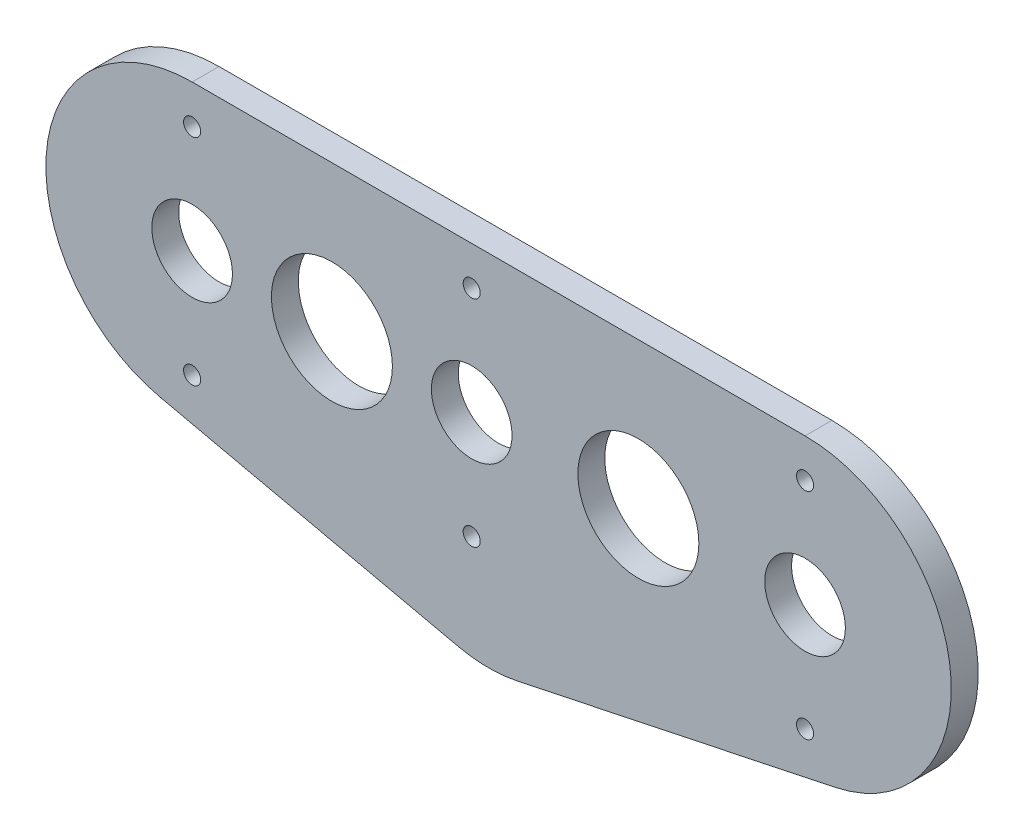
SolidWorks part; units mm, degrees
ref_plane "Front Plane" through (0, 0, 0) normal (0, 0, 1) x (1, 0, 0)
ref_plane "Top Plane" through (0, 0, 0) normal (0, 1, 0) x (1, 0, 0)
ref_plane "Right Plane" through (0, 0, 0) normal (1, 0, 0) x (0, 0, -1)
sketch "Sketch1" plane through (0, 0, 0) normal (0, 0, 1) x (1, 0, 0)
  line L0 (-70.031, 17.272) -> (-3.991, 17.272) construction
  line L1 (-3.991, 17.272) -> (74.749, 17.272) construction
  line L2 (-70.031, 49.276) -> (74.749, 49.276)
  line L3 (-70.031, 42.672) -> (74.749, 42.672) construction
  line L4 (-70.031, 42.672) -> (-70.031, -8.128) construction
  line L5 (-70.031, -8.128) -> (74.749, -8.128) construction
  line L6 (74.749, 42.672) -> (74.749, -8.128) construction
  line L7 (-70.031, -14.732) -> (-29.9849, -14.732) construction
  line L8 (0, -27.94) -> (0, -14.732) construction
  line L9 (-23.7405, -14.732) -> (23.7405, -14.732) construction
  line L10 (29.9849, -14.732) -> (74.749, -14.732) construction
  line L11 (-29.9849, -14.732) -> (-23.7405, -14.732) construction
  line L12 (29.9849, -14.732) -> (23.7405, -14.732) construction
  line L13 (-77.0364, -13.9559) -> (-6.6718, -29.7408)
  line L14 (81.3334, -14.0474) -> (6.2708, -29.828)
  circle A0 centre (-70.031, 17.272) radius 32.004 construction
  circle A1 centre (-3.991, 17.272) radius 32.004 construction
  circle A2 centre (74.749, 17.272) radius 32.004 construction
  circle A3 centre (-70.031, 17.272) radius 7.62 construction
  circle A4 centre (-3.991, 17.272) radius 7.62 construction
  circle A5 centre (74.749, 17.272) radius 7.62 construction
  circle A6 centre (-37.011, 17.272) radius 25.4 construction
  circle A7 centre (35.379, 17.272) radius 31.75 construction
  circle A8 centre (35.379, 17.272) radius 11.43 construction
  circle A9 centre (0, 0) radius 27.94 construction
  circle A10 centre (-70.031, 17.272) radius 25.4 construction
  circle A11 centre (-3.991, 17.272) radius 25.4 construction
  circle A12 centre (74.749, 17.272) radius 25.4 construction
  circle A13 centre (-70.031, 42.672) radius 2.0193
  circle A14 centre (-3.991, 42.672) radius 2.0193
  circle A15 centre (74.749, 42.672) radius 2.0193
  circle A16 centre (74.749, -8.128) radius 2.0193
  circle A17 centre (-3.991, -8.128) radius 2.0193
  circle A18 centre (-70.031, -8.128) radius 2.0193
  arc A19 (-70.031, 49.276) -> (-70.031, -14.732) centre (-70.031, 17.272) ccw construction
  arc A20 (74.749, -14.732) -> (74.749, 49.276) centre (74.749, 17.272) ccw construction
  circle A21 centre (-70.031, 17.272) radius 9.525
  circle A22 centre (-3.991, 17.272) radius 9.525
  circle A23 centre (74.749, 17.272) radius 9.525
  circle A24 centre (-37.011, 17.272) radius 14.2875
  circle A25 centre (35.379, 17.272) radius 14.2875
  arc A26 (-20.6146, -18.8595) -> (20.6146, -18.8595) centre (0, 0) ccw construction
  arc A27 (20.6146, -18.8595) -> (29.9849, -14.732) centre (29.9849, -27.432) cw construction
  arc A28 (-29.9849, -14.732) -> (-20.6146, -18.8595) centre (-29.9849, -27.432) cw construction
  arc A29 (-6.6718, -29.7408) -> (6.2708, -29.828) centre (0, 0) ccw
  arc A30 (81.3334, -14.0474) -> (74.749, 49.276) centre (74.749, 17.272) ccw
  arc A31 (-70.031, 49.276) -> (-77.0364, -13.9559) centre (-70.031, 17.272) ccw
  circle A32 centre (0, 0) radius 30.48 construction
  dimension "D1" = 64.008
  dimension "D2" = 15.24
  dimension "D3" = 50.8
  dimension "D4" = 22.86
  dimension "D5" = 55.88
  dimension "D6" = 63.5
  dimension "D7" = 50.8
  dimension "D8" = 4.0386
  dimension "D9" = 19.05
  dimension "D10" = 28.575
  dimension "D12" = 12.7
  dimension "D13" = 60.96
  dimension "D11" = 13.208
extrude "Boss-Extrude1" add sketch "Sketch1" along normal blind 6.35
sketch "Sketch2" plane through (0, 0, 6.35) normal (0, 0, 1) x (1, 0, 0)
  line L0 (-77.5923, -16.4343) -> (-7.2278, -32.2192)
  line L1 (6.7934, -32.3136) -> (81.8559, -16.533)
  line L2 (74.749, 51.816) -> (-70.031, 51.816)
  line L3 (-77.0364, -13.9559) -> (-6.6718, -29.7408)
  line L4 (6.2708, -29.828) -> (81.3334, -14.0474)
  line L5 (74.749, 49.276) -> (-70.031, 49.276)
  line L6 (-77.0364, -13.9559) -> (-6.6718, -29.7408)
  line L7 (6.2708, -29.828) -> (81.3334, -14.0474)
  line L8 (74.749, 49.276) -> (-70.031, 49.276)
  arc A0 (-7.2278, -32.2192) -> (6.7934, -32.3136) centre (0, 0) ccw
  arc A1 (81.8559, -16.533) -> (74.749, 51.816) centre (74.749, 17.272) ccw
  arc A2 (-70.031, 51.816) -> (-77.5923, -16.4343) centre (-70.031, 17.272) ccw
  arc A3 (-70.031, 49.276) -> (-77.0364, -13.9559) centre (-70.031, 17.272) ccw
  arc A4 (-6.6718, -29.7408) -> (6.2708, -29.828) centre (0, 0) ccw
  arc A5 (81.3334, -14.0474) -> (74.749, 49.276) centre (74.749, 17.272) ccw
  arc A6 (-70.031, 49.276) -> (-77.0364, -13.9559) centre (-70.031, 17.272) ccw
  arc A7 (-6.6718, -29.7408) -> (6.2708, -29.828) centre (0, 0) ccw
  arc A8 (81.3334, -14.0474) -> (74.749, 49.276) centre (74.749, 17.272) ccw
  dimension "D1" = 0
  dimension "D2" = 2.54
extrude "Boss-Extrude2" add sketch "Sketch2" against normal up to surface (6.35 mm away)
sketch "Sketch3" plane through (0, 0, 0) normal (0, 0, 1) x (1, 0, 0)
  circle A0 centre (-3.991, 42.672) radius 6.35
  circle A1 centre (-70.031, 42.672) radius 6.35
  circle A2 centre (-70.031, -8.128) radius 6.35
  circle A4 centre (74.749, -8.128) radius 6.6368
  circle A5 centre (74.749, 42.672) radius 6.6368
  dimension "D1" = 12.7
extrude "Cut-Extrude1" cut sketch "Sketch3" along normal blind 1.5875
sketch "Sketch4" plane through (0, 0, 0) normal (0, 0, -1) x (-1, 0, 0)
  line L0 (34.6297, 47.0535) -> (34.6297, 35.8656)
  line L1 (39.3922, 47.0535) -> (39.3922, 36.5579)
  line L2 (39.3922, 47.0535) -> (39.3922, 37.9095) construction
  line L3 (37.011, 47.0535) -> (37.011, 37.9095)
  line L4 (3.991, 42.672) -> (3.991, 31.61)
  line L5 (70.031, 42.672) -> (70.031, 32.2762)
  line L6 (70.031, 47.0535) -> (-74.749, 47.0535)
  line L7 (-80.8761, -11.8724) -> (-5.8136, -27.653)
  line L8 (6.1853, -27.5722) -> (76.5499, -11.7873)
  line L9 (70.031, 47.0535) -> (-74.749, 47.0535)
  line L10 (-80.8761, -11.8724) -> (-5.8136, -27.653)
  line L11 (6.1853, -27.5722) -> (76.5499, -11.7873)
  line L12 (-35.379, 47.0535) -> (-35.379, 35.8656)
  line L13 (34.6297, 47.0535) -> (34.6297, 37.9095) construction
  line L14 (70.031, -8.128) -> (70.031, 17.272)
  line L15 (-74.749, 17.272) -> (3.991, 17.272)
  line L16 (-74.749, 42.672) -> (-74.749, 17.272)
  line L17 (-74.749, 17.272) -> (-74.749, -8.128)
  line L18 (3.991, 17.272) -> (3.991, -27.9742)
  line L19 (3.991, -27.9742) -> (39.4531, -1.3988)
  line L20 (39.4531, -1.3988) -> (67.9227, -15.2605)
  line L21 (3.991, -27.9742) -> (-35.379, -1.3691)
  line L22 (-35.379, -1.3691) -> (-71.2909, -13.8875)
  line L26 (6.3722, 42.672) -> (6.3722, 31.61)
  line L27 (72.4122, 42.672) -> (72.4122, 32.2762)
  line L28 (-32.9978, 47.0535) -> (-32.9978, 35.8656)
  line L29 (-72.3678, 42.672) -> (-72.3678, 17.272)
  line L30 (-72.3678, 17.272) -> (-72.3678, -8.128)
  line L31 (-74.749, 19.6533) -> (6.3722, 19.6532)
  line L32 (6.3722, 19.6532) -> (6.3722, -23.214)
  line L33 (6.3722, -23.214) -> (39.1884, 1.3786)
  line L34 (39.1884, 1.3786) -> (68.9651, -13.1195)
  line L35 (-34.5952, -3.6177) -> (-70.5071, -16.1361)
  line L36 (1.6097, 42.672) -> (1.6097, 31.61)
  line L37 (67.6497, 42.672) -> (67.6497, 32.2762)
  line L38 (-37.7603, 47.0535) -> (-37.7603, 35.8656)
  line L39 (-77.1303, 42.672) -> (-77.1303, 17.272)
  line L40 (-77.1303, 17.272) -> (-77.1303, -8.128)
  line L41 (-74.749, 14.8908) -> (1.6097, 14.8907)
  line L42 (1.6097, 14.8907) -> (1.6097, -32.7345)
  line L43 (1.6097, -32.7345) -> (39.7178, -4.1761)
  line L44 (39.7178, -4.1761) -> (66.8803, -17.4014)
  line L45 (-36.1628, 0.8794) -> (-72.0747, -11.639)
  line L46 (5.3243, -26.0013) -> (-34.0457, 0.6038)
  line L47 (2.6577, -29.9472) -> (-36.7123, -3.3421)
  line L48 (72.4122, -8.128) -> (72.4122, 17.272)
  line L49 (67.6497, -8.128) -> (67.6497, 17.272)
  circle A1 centre (3.991, 42.672) radius 7.9375
  circle A2 centre (70.031, 42.672) radius 7.9375
  circle A3 centre (70.031, -8.128) radius 7.9375
  circle A4 centre (3.991, -8.128) radius 7.9375
  circle A5 centre (-74.749, -8.128) radius 7.9375
  circle A6 centre (-74.749, 42.672) radius 7.9375
  arc A12 (76.5499, -11.7873) -> (70.031, 47.0535) centre (70.031, 17.272) ccw
  arc A13 (-74.749, 47.0535) -> (-80.8761, -11.8724) centre (-74.749, 17.272) ccw
  arc A14 (-5.8136, -27.653) -> (6.1853, -27.5722) centre (0, 0) ccw
  arc A15 (76.5499, -11.7873) -> (70.031, 47.0535) centre (70.031, 17.272) ccw
  arc A16 (-74.749, 47.0535) -> (-80.8761, -11.8724) centre (-74.749, 17.272) ccw
  arc A17 (-5.8136, -27.653) -> (6.1853, -27.5722) centre (0, 0) ccw
  circle A20 centre (-74.749, 17.272) radius 15.875
  circle A21 centre (-74.749, 17.272) radius 15.875
  circle A23 centre (-35.379, 17.272) radius 20.6375
  circle A24 centre (-35.379, 17.272) radius 20.6375
  circle A26 centre (3.991, 17.272) radius 15.875
  circle A27 centre (3.991, 17.272) radius 15.875
  circle A29 centre (37.011, 17.272) radius 20.6375
  circle A30 centre (37.011, 17.272) radius 20.6375
  circle A32 centre (70.031, 17.272) radius 15.875
  circle A33 centre (70.031, 17.272) radius 15.875
  dimension "D13" = 2.3813
  dimension "D1" = 15.875
  dimension "D2" = 4.7625
  dimension "D3" = 6.35
  dimension "D4" = 6.35
  dimension "D5" = 6.35
  dimension "D6" = 6.35
  dimension "D7" = 6.35
  dimension "D8" = 2.3813
  dimension "D9" = 2.3813
  dimension "D10" = 2.3813
  dimension "D11" = 2.3813
  dimension "D12" = 2.3813
  dimension "D14" = 2.3813
  dimension "D15" = 2.3813
extrude "Cut-Extrude2" cut sketch "Sketch4" against normal blind 4.7625 contours A21 L39 A6 A16 A5 L40 | A24 L38 L9 A6 L29 A21 L31 | A27 L36 A1 L9 L28 A24 L31 | A27 L41 A24 L46 L42 A4 | A24 L41 A21 L30 A5 L45 | L10 A17 L47 L35 | A30 A27 L32 A4 L33 | L44 L43 L11 | A33 A30 L34 A3 L14 | A33 L14 A3 A15 A2 L27 | A33 L37 A2 L9 L1 A30 | A30 L0 L9 A1 L26 A27
fillet "Fillet1" radius 3.81 49 edges at (-33.3055, -3.0301, 2.3813) (-9.4863, -26.8317, 2.3813) (-39.7178, -4.1761, 2.3813) (-62.0366, -15.0431, 2.3813) (-62.2865, -9.8677, 2.3813) (-45.333, -1.6132, 2.3813) (-56.1541, 9.5618, 2.3813) (-67.6497, 1.5766, 2.3813) (-77.1457, -11.6472, 2.3813) (-72.4122, 1.5766, 2.3813) (-77.1457, 46.1912, 2.3813) (-56.1541, 24.9822, 2.3813) (-72.4122, 35.1001, 2.3813) (-67.6497, 35.1001, 2.3813) (-63.4123, 47.0535, 2.3813) (-39.3922, 47.0535, 2.3813) (-39.3922, 37.7717, 2.3813) (-34.6297, 37.7717, 2.3813) (-34.6297, 47.0535, 2.3813) (-17.8679, 9.5618, 2.3813) (-17.8679, 24.9822, 2.3813) (-10.6096, 47.0535, 2.3813) (-6.3722, 32.9674, 2.3813) (2.6277, 47.0535, 2.3813) (-1.6097, 32.9674, 2.3813) (-1.6097, 1.5766, 2.3813) (81.8637, -11.6472, 2.3813) (77.1303, -0.5561, 2.3813) (32.9978, 37.7717, 2.3813) (14.8794, 19.6533, 2.3813) (14.8794, 14.8908, 2.3813) (29.4565, -2.4974, 2.3813) (-6.3722, -23.214, 2.3813) (-1.6097, -23.4911, 2.3813) (-0.1566, -28.2571, 2.3813) (35.7229, -4.0108, 2.3813) (66.7782, -14.8362, 2.3813) (72.3678, -0.5561, 2.3813) (67.0055, -9.8719, 2.3813) (43.5287, -1.6882, 2.3813) (55.8787, 14.8908, 2.3813) (55.8787, 19.6533, 2.3813) (37.7603, 37.7717, 2.3813) (81.8637, 46.1912, 2.3813) (77.1303, 35.1001, 2.3813) (72.3678, 35.1001, 2.3813) (68.1304, 47.0535, 2.3813) (32.9978, 47.0535, 2.3813) (37.7603, 47.0535, 2.3813)
sketch "Sketch5" plane through (0, 0, 0) normal (0, 0, -1) x (-1, 0, 0)
  line L0 (51.4159, -4.5749) -> (57.3503, -7.4643) construction
  line L1 (58.2974, 47.0535) -> (43.2022, 47.0535) construction
  line L2 (12.4657, -18.6475) -> (27.6469, -7.2707)
  line L3 (-11.7044, 14.8907) -> (-11.7285, 14.8907)
  line L4 (-23.9448, -6.2221) -> (-4.3335, -19.4748)
  line L5 (1.6097, -16.318) -> (1.6097, -15.6999)
  line L6 (-11.7044, 14.8907) -> (-11.7285, 14.8907)
  line L7 (-23.9448, -6.2221) -> (-4.3335, -19.4748)
  line L8 (1.6097, -16.318) -> (1.6097, -15.6999)
  line L9 (6.3722, 1.5766) -> (6.3722, -0.5561)
  line L10 (12.4657, -18.6475) -> (27.6469, -7.2707)
  line L11 (6.3722, 1.5766) -> (6.3722, -0.5561)
  line L12 (39.3922, 43.2435) -> (39.3922, 40.9226) construction
  line L13 (34.6297, 40.9226) -> (34.6297, 43.2435) construction
  line L14 (30.8197, 47.0535) -> (15.7246, 47.0535) construction
  line L15 (-7.7426, 47.0535) -> (-29.1878, 47.0535) construction
  line L16 (-32.9978, 43.2435) -> (-32.9978, 40.9226) construction
  line L17 (-11.7285, 19.6533) -> (-11.7044, 19.6533) construction
  line L18 (-59.0536, 19.6533) -> (-59.0296, 19.6533) construction
  line L19 (-37.7603, 40.9226) -> (-37.7603, 43.2435) construction
  line L20 (-41.5703, 47.0535) -> (-63.0154, 47.0535) construction
  line L21 (-62.2811, -8.2251) -> (-50.785, -4.2177) construction
  line L22 (-59.0296, 14.8908) -> (-59.0536, 14.8908) construction
  line L23 (51.4159, -4.5749) -> (57.3503, -7.4643)
  line L24 (58.2974, 47.0535) -> (43.2022, 47.0535)
  line L25 (39.3922, 43.2435) -> (39.3922, 40.9226)
  line L26 (34.6297, 40.9226) -> (34.6297, 43.2435)
  line L27 (30.8197, 47.0535) -> (15.7246, 47.0535)
  line L28 (-7.7426, 47.0535) -> (-29.1878, 47.0535)
  line L29 (-32.9978, 43.2435) -> (-32.9978, 40.9226)
  line L30 (-11.7285, 19.6533) -> (-11.7044, 19.6533)
  line L31 (-59.0536, 19.6533) -> (-59.0296, 19.6533)
  line L32 (-37.7603, 40.9226) -> (-37.7603, 43.2435)
  line L33 (-41.5703, 47.0535) -> (-63.0154, 47.0535)
  line L34 (-62.2811, -8.2251) -> (-50.785, -4.2177)
  line L35 (-59.0296, 14.8908) -> (-59.0536, 14.8908)
  arc A0 (57.3503, -7.4643) -> (62.5899, -5.365) centre (59.0182, -4.0388) ccw construction
  arc A1 (67.6497, -0.5561) -> (62.5899, -5.365) centre (70.031, -8.128) ccw construction
  arc A2 (67.6497, -0.5561) -> (65.1236, 2.1746) centre (63.9458, -1.4488) ccw construction
  arc A3 (59.2831, 5.5887) -> (65.1236, 2.1746) centre (70.031, 17.272) ccw construction
  arc A4 (59.2831, 5.5887) -> (53.6346, 5.0425) centre (56.7036, 2.7847) ccw construction
  arc A5 (50.5789, 1.7215) -> (53.6346, 5.0425) centre (37.011, 17.272) ccw construction
  arc A6 (27.6469, -7.2707) -> (27.1775, -0.8721) centre (25.3621, -4.2218) ccw
  arc A7 (1.6097, -0.5561) -> (1.6097, -15.6999) centre (3.991, -8.128) ccw
  arc A8 (1.6097, -0.5561) -> (-0.9164, 2.1746) centre (-2.0942, -1.4488) ccw
  arc A9 (-11.7044, 14.8907) -> (-0.9164, 2.1746) centre (3.991, 17.272) ccw
  arc A10 (-11.7285, 14.8907) -> (-15.4143, 12.0456) centre (-11.7285, 11.0808) ccw
  arc A11 (-23.926, 0.1042) -> (-15.4143, 12.0456) centre (-35.379, 17.272) ccw
  arc A12 (-23.926, 0.1042) -> (-23.9448, -6.2221) centre (-21.8116, -3.0653) ccw
  arc A13 (-4.3335, -19.4748) -> (1.6097, -16.318) centre (-2.2003, -16.318) ccw
  arc A14 (1.6097, -0.5561) -> (1.6097, -15.6999) centre (3.991, -8.128) ccw
  arc A15 (1.6097, -0.5561) -> (-0.9164, 2.1746) centre (-2.0942, -1.4488) ccw
  arc A16 (-11.7044, 14.8907) -> (-0.9164, 2.1746) centre (3.991, 17.272) ccw
  arc A17 (-11.7285, 14.8907) -> (-15.4143, 12.0456) centre (-11.7285, 11.0808) ccw
  arc A18 (-23.926, 0.1042) -> (-15.4143, 12.0456) centre (-35.379, 17.272) ccw
  arc A19 (-23.926, 0.1042) -> (-23.9448, -6.2221) centre (-21.8116, -3.0653) ccw
  arc A20 (-4.3335, -19.4748) -> (1.6097, -16.318) centre (-2.2003, -16.318) ccw
  arc A21 (20.3873, 5.0425) -> (27.1775, -0.8721) centre (37.011, 17.272) ccw
  arc A22 (20.3873, 5.0425) -> (14.7389, 5.5887) centre (17.3183, 2.7847) ccw
  arc A23 (6.3722, 1.5766) -> (14.7389, 5.5887) centre (3.991, 17.272) ccw
  arc A24 (6.3722, -15.6999) -> (6.3722, -0.5561) centre (3.991, -8.128) ccw
  arc A25 (6.3722, -15.6999) -> (12.4657, -18.6475) centre (10.1809, -15.5986) ccw
  arc A26 (27.6469, -7.2707) -> (27.1775, -0.8721) centre (25.3621, -4.2218) ccw
  arc A27 (20.3873, 5.0425) -> (27.1775, -0.8721) centre (37.011, 17.272) ccw
  arc A28 (20.3873, 5.0425) -> (14.7389, 5.5887) centre (17.3183, 2.7847) ccw
  arc A29 (6.3722, 1.5766) -> (14.7389, 5.5887) centre (3.991, 17.272) ccw
  arc A30 (6.3722, -15.6999) -> (6.3722, -0.5561) centre (3.991, -8.128) ccw
  arc A31 (6.3722, -15.6999) -> (12.4657, -18.6475) centre (10.1809, -15.5986) ccw
  arc A32 (50.5789, 1.7215) -> (51.4159, -4.5749) centre (53.0838, -1.1493) ccw construction
  arc A33 (77.8358, -6.6829) -> (72.4122, -0.5561) centre (70.031, -8.128) ccw construction
  arc A34 (77.8358, -6.6829) -> (83.2767, -9.4017) centre (81.5822, -5.9893) ccw construction
  arc A35 (83.2767, -9.4017) -> (83.2767, 43.9457) centre (70.031, 17.272) ccw construction
  arc A36 (83.2767, 43.9457) -> (77.8358, 41.2269) centre (81.5822, 40.5333) ccw construction
  arc A37 (74.207, 35.9218) -> (77.8358, 41.2269) centre (70.031, 42.672) ccw construction
  arc A38 (74.207, 35.9218) -> (72.4122, 32.9674) centre (76.2115, 32.6818) ccw construction
  arc A39 (74.9384, 2.1746) -> (72.4122, 32.9674) centre (70.031, 17.272) ccw construction
  arc A40 (74.9384, 2.1746) -> (72.4122, -0.5561) centre (76.1162, -1.4488) ccw construction
  arc A41 (53.6346, 29.5015) -> (42.2374, 37.2368) centre (37.011, 17.272) ccw construction
  arc A42 (53.6346, 29.5015) -> (59.2831, 28.9553) centre (56.7036, 31.7593) ccw construction
  arc A43 (67.6497, 32.9674) -> (59.2831, 28.9553) centre (70.031, 17.272) ccw construction
  arc A44 (67.6497, 32.9674) -> (65.8549, 35.9218) centre (63.8505, 32.6818) ccw construction
  arc A45 (62.1029, 43.0581) -> (65.8549, 35.9218) centre (70.031, 42.672) ccw construction
  arc A46 (62.1029, 43.0581) -> (58.2974, 47.0535) centre (58.2974, 43.2435) ccw construction
  arc A47 (43.2022, 47.0535) -> (39.3922, 43.2435) centre (43.2022, 43.2435) ccw construction
  arc A48 (39.3922, 40.9226) -> (42.2374, 37.2368) centre (43.2022, 40.9226) ccw construction
  arc A49 (31.7846, 37.2368) -> (20.3873, 29.5015) centre (37.011, 17.272) ccw construction
  arc A50 (31.7846, 37.2368) -> (34.6297, 40.9226) centre (30.8197, 40.9226) ccw construction
  arc A51 (34.6297, 43.2435) -> (30.8197, 47.0535) centre (30.8197, 43.2435) ccw construction
  arc A52 (15.7246, 47.0535) -> (11.9191, 43.0581) centre (15.7246, 43.2435) ccw construction
  arc A53 (6.3722, 35.1001) -> (11.9191, 43.0581) centre (3.991, 42.672) ccw construction
  arc A54 (6.3722, 35.1001) -> (8.8984, 32.3694) centre (10.0762, 35.9928) ccw construction
  arc A55 (14.7389, 28.9553) -> (8.8984, 32.3694) centre (3.991, 17.272) ccw construction
  arc A56 (14.7389, 28.9553) -> (20.3873, 29.5015) centre (17.3183, 31.7593) ccw construction
  arc A57 (-3.9371, 43.0581) -> (1.6097, 35.1001) centre (3.991, 42.672) ccw construction
  arc A58 (-3.9371, 43.0581) -> (-7.7426, 47.0535) centre (-7.7426, 43.2435) ccw construction
  arc A59 (-29.1878, 47.0535) -> (-32.9978, 43.2435) centre (-29.1878, 43.2435) ccw construction
  arc A60 (-32.9978, 40.9226) -> (-30.1526, 37.2368) centre (-29.1878, 40.9226) ccw construction
  arc A61 (-15.4143, 22.4984) -> (-30.1526, 37.2368) centre (-35.379, 17.272) ccw construction
  arc A62 (-15.4143, 22.4984) -> (-11.7285, 19.6533) centre (-11.7285, 23.4633) ccw construction
  arc A63 (-0.9164, 32.3694) -> (-11.7044, 19.6533) centre (3.991, 17.272) ccw construction
  arc A64 (-0.9164, 32.3694) -> (1.6097, 35.1001) centre (-2.0942, 35.9928) ccw construction
  arc A65 (-59.0296, 19.6533) -> (-55.3438, 22.4984) centre (-59.0296, 23.4633) ccw construction
  arc A66 (-40.6054, 37.2368) -> (-55.3438, 22.4984) centre (-35.379, 17.272) ccw construction
  arc A67 (-40.6054, 37.2368) -> (-37.7603, 40.9226) centre (-41.5703, 40.9226) ccw construction
  arc A68 (-37.7603, 43.2435) -> (-41.5703, 47.0535) centre (-41.5703, 43.2435) ccw construction
  arc A69 (-63.0154, 47.0535) -> (-66.8209, 43.0581) centre (-63.0154, 43.2435) ccw construction
  arc A70 (-70.573, 35.9218) -> (-66.8209, 43.0581) centre (-74.749, 42.672) ccw construction
  arc A71 (-70.573, 35.9218) -> (-72.3678, 32.9674) centre (-68.5685, 32.6818) ccw construction
  arc A72 (-59.0536, 19.6533) -> (-72.3678, 32.9674) centre (-74.749, 17.272) ccw construction
  arc A73 (-87.9947, 43.9457) -> (-87.9947, -9.4017) centre (-74.749, 17.272) ccw construction
  arc A74 (-87.9947, -9.4017) -> (-82.5539, -6.6829) centre (-86.3002, -5.9893) ccw construction
  arc A75 (-78.9251, -1.3778) -> (-82.5539, -6.6829) centre (-74.749, -8.128) ccw construction
  arc A76 (-78.9251, -1.3778) -> (-77.1303, 1.5766) centre (-80.9295, 1.8622) ccw construction
  arc A77 (-77.1303, 32.9674) -> (-77.1303, 1.5766) centre (-74.749, 17.272) ccw construction
  arc A78 (-77.1303, 32.9674) -> (-78.9251, 35.9218) centre (-80.9295, 32.6818) ccw construction
  arc A79 (-82.5539, 41.2269) -> (-78.9251, 35.9218) centre (-74.749, 42.672) ccw construction
  arc A80 (-82.5539, 41.2269) -> (-87.9947, 43.9457) centre (-86.3002, 40.5333) ccw construction
  arc A81 (-72.3678, 1.5766) -> (-59.0536, 14.8908) centre (-74.749, 17.272) ccw construction
  arc A82 (-72.3678, 1.5766) -> (-70.573, -1.3778) centre (-68.5685, 1.8622) ccw construction
  arc A83 (-67.1721, -5.7627) -> (-70.573, -1.3778) centre (-74.749, -8.128) ccw construction
  arc A84 (-67.1721, -5.7627) -> (-62.2811, -8.2251) centre (-63.5352, -4.6274) ccw construction
  arc A85 (-50.785, -4.2177) -> (-49.4427, 2.1684) centre (-52.0391, -0.62) ccw construction
  arc A86 (-55.3438, 12.0456) -> (-49.4427, 2.1684) centre (-35.379, 17.272) ccw construction
  arc A87 (-55.3438, 12.0456) -> (-59.0296, 14.8908) centre (-59.0296, 11.0808) ccw construction
  arc A88 (57.3503, -7.4643) -> (62.5899, -5.365) centre (59.0182, -4.0388) ccw
  arc A89 (67.6497, -0.5561) -> (62.5899, -5.365) centre (70.031, -8.128) ccw
  arc A90 (67.6497, -0.5561) -> (65.1236, 2.1746) centre (63.9458, -1.4488) ccw
  arc A91 (59.2831, 5.5887) -> (65.1236, 2.1746) centre (70.031, 17.272) ccw
  arc A92 (59.2831, 5.5887) -> (53.6346, 5.0425) centre (56.7036, 2.7847) ccw
  arc A93 (50.5789, 1.7215) -> (53.6346, 5.0425) centre (37.011, 17.272) ccw
  arc A94 (50.5789, 1.7215) -> (51.4159, -4.5749) centre (53.0838, -1.1493) ccw
  arc A95 (77.8358, -6.6829) -> (72.4122, -0.5561) centre (70.031, -8.128) ccw
  arc A96 (77.8358, -6.6829) -> (83.2767, -9.4017) centre (81.5822, -5.9893) ccw
  arc A97 (83.2767, -9.4017) -> (83.2767, 43.9457) centre (70.031, 17.272) ccw
  arc A98 (83.2767, 43.9457) -> (77.8358, 41.2269) centre (81.5822, 40.5333) ccw
  arc A99 (74.207, 35.9218) -> (77.8358, 41.2269) centre (70.031, 42.672) ccw
  arc A100 (74.207, 35.9218) -> (72.4122, 32.9674) centre (76.2115, 32.6818) ccw
  arc A101 (74.9384, 2.1746) -> (72.4122, 32.9674) centre (70.031, 17.272) ccw
  arc A102 (74.9384, 2.1746) -> (72.4122, -0.5561) centre (76.1162, -1.4488) ccw
  arc A103 (53.6346, 29.5015) -> (42.2374, 37.2368) centre (37.011, 17.272) ccw
  arc A104 (53.6346, 29.5015) -> (59.2831, 28.9553) centre (56.7036, 31.7593) ccw
  arc A105 (67.6497, 32.9674) -> (59.2831, 28.9553) centre (70.031, 17.272) ccw
  arc A106 (67.6497, 32.9674) -> (65.8549, 35.9218) centre (63.8505, 32.6818) ccw
  arc A107 (62.1029, 43.0581) -> (65.8549, 35.9218) centre (70.031, 42.672) ccw
  arc A108 (62.1029, 43.0581) -> (58.2974, 47.0535) centre (58.2974, 43.2435) ccw
  arc A109 (43.2022, 47.0535) -> (39.3922, 43.2435) centre (43.2022, 43.2435) ccw
  arc A110 (39.3922, 40.9226) -> (42.2374, 37.2368) centre (43.2022, 40.9226) ccw
  arc A111 (31.7846, 37.2368) -> (20.3873, 29.5015) centre (37.011, 17.272) ccw
  arc A112 (31.7846, 37.2368) -> (34.6297, 40.9226) centre (30.8197, 40.9226) ccw
  arc A113 (34.6297, 43.2435) -> (30.8197, 47.0535) centre (30.8197, 43.2435) ccw
  arc A114 (15.7246, 47.0535) -> (11.9191, 43.0581) centre (15.7246, 43.2435) ccw
  arc A115 (6.3722, 35.1001) -> (11.9191, 43.0581) centre (3.991, 42.672) ccw
  arc A116 (6.3722, 35.1001) -> (8.8984, 32.3694) centre (10.0762, 35.9928) ccw
  arc A117 (14.7389, 28.9553) -> (8.8984, 32.3694) centre (3.991, 17.272) ccw
  arc A118 (14.7389, 28.9553) -> (20.3873, 29.5015) centre (17.3183, 31.7593) ccw
  arc A119 (-3.9371, 43.0581) -> (1.6097, 35.1001) centre (3.991, 42.672) ccw
  arc A120 (-3.9371, 43.0581) -> (-7.7426, 47.0535) centre (-7.7426, 43.2435) ccw
  arc A121 (-29.1878, 47.0535) -> (-32.9978, 43.2435) centre (-29.1878, 43.2435) ccw
  arc A122 (-32.9978, 40.9226) -> (-30.1526, 37.2368) centre (-29.1878, 40.9226) ccw
  arc A123 (-15.4143, 22.4984) -> (-30.1526, 37.2368) centre (-35.379, 17.272) ccw
  arc A124 (-15.4143, 22.4984) -> (-11.7285, 19.6533) centre (-11.7285, 23.4633) ccw
  arc A125 (-0.9164, 32.3694) -> (-11.7044, 19.6533) centre (3.991, 17.272) ccw
  arc A126 (-0.9164, 32.3694) -> (1.6097, 35.1001) centre (-2.0942, 35.9928) ccw
  arc A127 (-59.0296, 19.6533) -> (-55.3438, 22.4984) centre (-59.0296, 23.4633) ccw
  arc A128 (-40.6054, 37.2368) -> (-55.3438, 22.4984) centre (-35.379, 17.272) ccw
  arc A129 (-40.6054, 37.2368) -> (-37.7603, 40.9226) centre (-41.5703, 40.9226) ccw
  arc A130 (-37.7603, 43.2435) -> (-41.5703, 47.0535) centre (-41.5703, 43.2435) ccw
  arc A131 (-63.0154, 47.0535) -> (-66.8209, 43.0581) centre (-63.0154, 43.2435) ccw
  arc A132 (-70.573, 35.9218) -> (-66.8209, 43.0581) centre (-74.749, 42.672) ccw
  arc A133 (-70.573, 35.9218) -> (-72.3678, 32.9674) centre (-68.5685, 32.6818) ccw
  arc A134 (-59.0536, 19.6533) -> (-72.3678, 32.9674) centre (-74.749, 17.272) ccw
  arc A135 (-87.9947, 43.9457) -> (-87.9947, -9.4017) centre (-74.749, 17.272) ccw
  arc A136 (-87.9947, -9.4017) -> (-82.5539, -6.6829) centre (-86.3002, -5.9893) ccw
  arc A137 (-78.9251, -1.3778) -> (-82.5539, -6.6829) centre (-74.749, -8.128) ccw
  arc A138 (-78.9251, -1.3778) -> (-77.1303, 1.5766) centre (-80.9295, 1.8622) ccw
  arc A139 (-77.1303, 32.9674) -> (-77.1303, 1.5766) centre (-74.749, 17.272) ccw
  arc A140 (-77.1303, 32.9674) -> (-78.9251, 35.9218) centre (-80.9295, 32.6818) ccw
  arc A141 (-82.5539, 41.2269) -> (-78.9251, 35.9218) centre (-74.749, 42.672) ccw
  arc A142 (-82.5539, 41.2269) -> (-87.9947, 43.9457) centre (-86.3002, 40.5333) ccw
  arc A143 (-72.3678, 1.5766) -> (-59.0536, 14.8908) centre (-74.749, 17.272) ccw
  arc A144 (-72.3678, 1.5766) -> (-70.573, -1.3778) centre (-68.5685, 1.8622) ccw
  arc A145 (-67.1721, -5.7627) -> (-70.573, -1.3778) centre (-74.749, -8.128) ccw
  arc A146 (-67.1721, -5.7627) -> (-62.2811, -8.2251) centre (-63.5352, -4.6274) ccw
  arc A147 (-50.785, -4.2177) -> (-49.4427, 2.1684) centre (-52.0391, -0.62) ccw
  arc A148 (-55.3438, 12.0456) -> (-49.4427, 2.1684) centre (-35.379, 17.272) ccw
  arc A149 (-55.3438, 12.0456) -> (-59.0296, 14.8908) centre (-59.0296, 11.0808) ccw
  circle A150 centre (-83.5434, 34.8833) radius 3.81
  circle A151 centre (-65.9547, 34.8833) radius 3.81
  circle A152 centre (-57.7333, 27.1697) radius 3.81
  circle A153 centre (-57.7333, 7.3743) radius 3.81
  circle A154 centre (-65.9547, -0.3393) radius 3.81
  circle A155 centre (-83.5434, -0.3393) radius 3.81
  circle A156 centre (-13.0247, 7.3743) radius 3.81
  circle A157 centre (-4.8034, -0.3393) radius 3.81
  circle A158 centre (12.7853, -0.3393) radius 3.81
  circle A159 centre (12.7853, 34.8833) radius 3.81
  circle A160 centre (-4.8034, 34.8833) radius 3.81
  circle A161 centre (-13.0247, 27.1697) radius 3.81
  circle A162 centre (61.2366, 34.8833) radius 3.81
  circle A163 centre (78.8253, 34.8833) radius 3.81
  circle A164 centre (78.8253, -0.3393) radius 3.81
  circle A165 centre (61.2366, -0.3393) radius 3.81
  dimension "D3" = 7.62
  dimension "D1" = 0
  dimension "D2" = 0
extrude "Boss-Extrude3" add sketch "Sketch5" against normal up to surface (4.7625 mm away) contours A150 A139 A140 A141 | A151 A132 A133 A134 | A152 A134 L31 A127 A128 | A153 A148 A149 L35 A143 | A154 A143 A144 A145 | A155 A137 A138 A139 | A156 A16 L6 A17 A18 | A157 A14 A15 A16 | A160 A125 A126 A119 | A161 A123 A124 L30 A125 | A159 A115 A116 A117 | A162 A105 A106 A107 | A163 A99 A100 A101 | A164 A101 A102 A95 | A165 A89 A90 A91 | A158 A29 L11 A30
